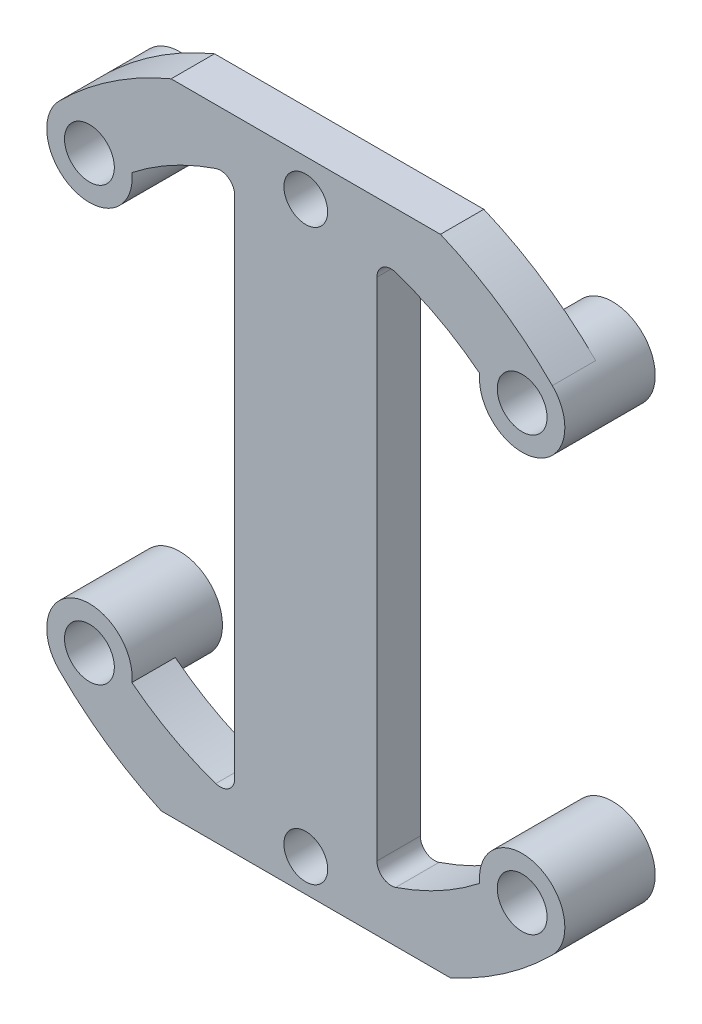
SolidWorks part; units mm, degrees
ref_plane "Front Plane" through (0, 0, 0) normal (0, 0, 1) x (1, 0, 0)
ref_plane "Top Plane" through (0, 0, 0) normal (0, 1, 0) x (1, 0, 0)
ref_plane "Right Plane" through (0, 0, 0) normal (1, 0, 0) x (0, 0, -1)
sketch "Sketch1" plane through (0, 0, 0) normal (0, 0, 1) x (1, 0, 0)
  line L0 (0, 0) -> (5, 0) construction
  line L1 (-10.1534, -22.2971) -> (10.1534, -22.2971)
  line L2 (-5, -12.2028) -> (-5, 12.2028)
  line L3 (-9.4611, 22.5995) -> (9.4611, 22.5995)
  line L4 (5, -12.2028) -> (5, 12.2028)
  line L5 (0, 0) -> (-5, 0) construction
  line L11 (-15.2028, -15.2028) -> (-15.2028, -12.2028) construction
  line L12 (-15.2028, 15.2028) -> (-15.2028, 12.2028) construction
  line L14 (-5, 12.2028) -> (-21.2448, 12.2028)
  line L15 (-5, -12.2028) -> (-21.2448, -12.2028)
  line L16 (5, 12.2028) -> (21.2448, 12.2028)
  line L18 (5, -12.2028) -> (21.2448, -12.2028)
  circle A0 centre (0, 0) radius 21.5 construction
  circle A1 centre (0, 20) radius 1.5367
  circle A2 centre (0, -20) radius 1.5367
  circle A4 centre (15.2028, 15.2028) radius 1.75
  circle A5 centre (15.2028, -15.2028) radius 1.75
  circle A6 centre (-15.2028, -15.2028) radius 1.75
  circle A7 centre (-15.2028, 15.2028) radius 1.75
  arc A8 (-21.2448, -12.2028) -> (-10.1534, -22.2971) centre (0, 0) ccw construction
  arc A10 (-21.2448, -12.2028) -> (-10.1534, -22.2971) centre (0, 0) ccw
  arc A11 (21.2448, 12.2028) -> (9.4611, 22.5995) centre (0, 0) ccw construction
  arc A12 (21.2448, 12.2028) -> (9.4611, 22.5995) centre (0, 0) ccw
  arc A13 (-9.4611, 22.5995) -> (-21.2448, 12.2028) centre (0, 0) ccw construction
  arc A14 (-9.4611, 22.5995) -> (-21.2448, 12.2028) centre (0, 0) ccw
  arc A15 (10.1534, -22.2971) -> (21.2448, -12.2028) centre (0, 0) ccw construction
  arc A16 (10.1534, -22.2971) -> (21.2448, -12.2028) centre (0, 0) ccw
  circle A17 centre (0, 20) radius 2.032 construction
  circle A18 centre (0, -20) radius 2.032 construction
  dimension "D3" = 43
  dimension "D11" = 3.5
  dimension "D12" = 49
  dimension "D2" = 4.064
  dimension "D4" = 20
  dimension "D5" = 10
  dimension "D6" = 20
  dimension "D8" = 90
  dimension "D9" = 90
  dimension "D10" = 90
extrude "Boss-Extrude1" add sketch "Sketch1" along normal blind 3.048
sketch "Sketch2" plane through (0, 0, 3.048) normal (0, 0, 1) x (1, 0, 0)
  line L14 (5, 19.1066) -> (5, -19.1066)
  line L16 (-5, 19.1066) -> (-5, -19.1066)
  arc A4 (-17.3241, 17.3241) -> (-12.2192, 15.5162) centre (-15.2028, 15.2028) ccw
  arc A5 (-12.2192, -15.5162) -> (-17.3241, -17.3241) centre (-15.2028, -15.2028) ccw
  arc A6 (17.3241, -17.3241) -> (12.2192, -15.5162) centre (15.2028, -15.2028) ccw
  arc A7 (12.2192, 15.5162) -> (17.3241, 17.3241) centre (15.2028, 15.2028) ccw
  arc A10 (-5, 19.1066) -> (-12.2192, 15.5162) centre (0, 0) ccw
  arc A11 (12.2192, 15.5162) -> (5, 19.1066) centre (0, 0) ccw
  arc A13 (-12.2192, -15.5162) -> (-5, -19.1066) centre (0, 0) ccw
  arc A14 (5, -19.1066) -> (12.2192, -15.5162) centre (0, 0) ccw
  arc A15 (17.3241, -17.3241) -> (17.3241, 17.3241) centre (0, 0) ccw
  arc A16 (-17.3241, 17.3241) -> (-17.3241, -17.3241) centre (0, 0) ccw
  point P5 (0, 0)
  point P6 (0, 0)
  point P17 (0, 0)
  point P18 (0, 0)
  point P19 (0, 0)
  dimension "D1" = 6
extrude "Cut-Extrude2" cut sketch "Sketch2" against normal through all
sketch "Sketch3" plane through (0, 0, 3.048) normal (0, 0, 1) x (1, 0, 0)
  circle A0 centre (-15.2028, -15.2028) radius 3
  circle A1 centre (-15.2028, 15.2028) radius 3
  circle A2 centre (15.2028, 15.2028) radius 3
  circle A3 centre (15.2028, -15.2028) radius 3
  circle A4 centre (15.2028, -15.2028) radius 1.75
  circle A5 centre (-15.2028, -15.2028) radius 1.7675
  circle A6 centre (-15.2028, 15.2028) radius 1.7985
  circle A7 centre (15.2028, 15.2028) radius 1.75
extrude "Boss-Extrude2" add sketch "Sketch3" against normal blind 6.35
fillet "Fillet1" radius 1 1 edges at (-5, 19.1066, 1.524)
fillet "Fillet2" radius 1 1 edges at (5, 19.1066, 1.524)
fillet "Fillet3" radius 1 1 edges at (5, -19.1066, 1.524)
fillet "Fillet4" radius 1 1 edges at (-5, -19.1066, 1.524)
